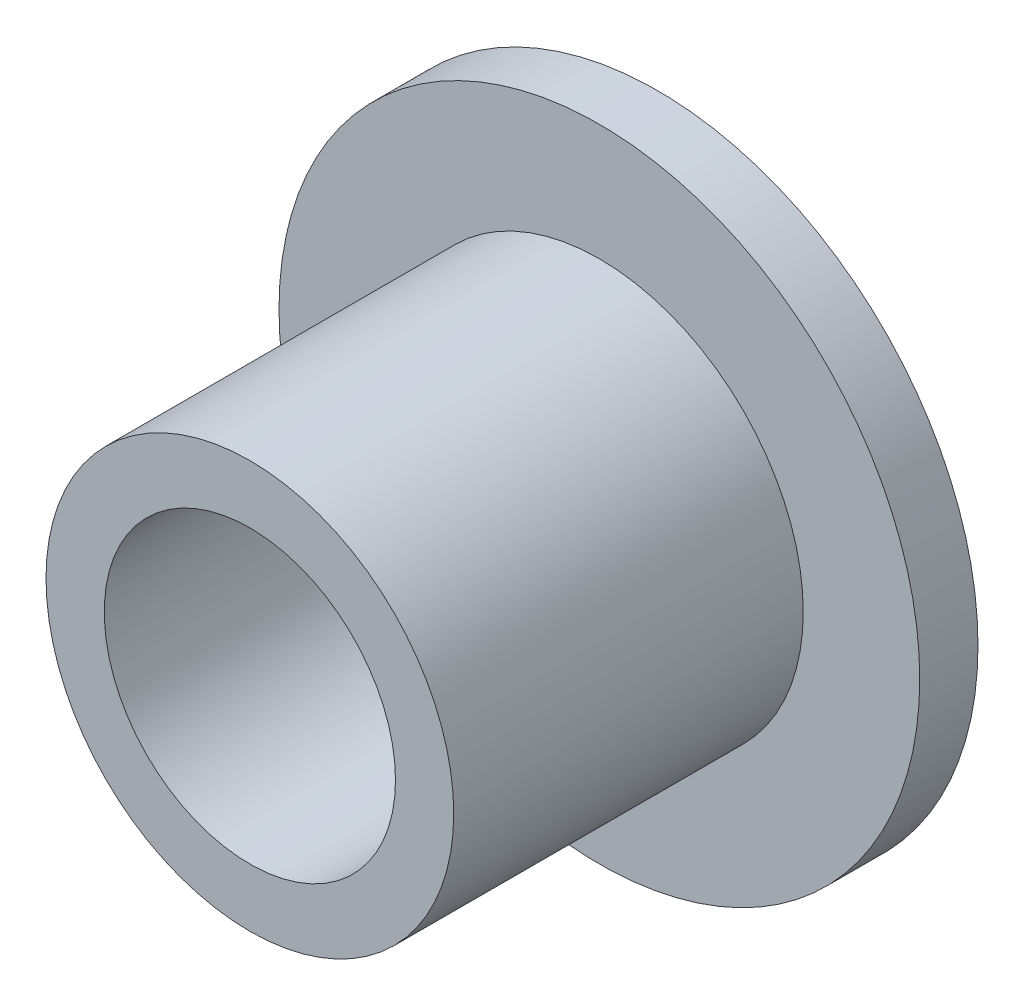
SolidWorks part; units mm, degrees
ref_plane "Ebene vorne" through (0, 0, 0) normal (0, 0, 1) x (1, 0, 0)
ref_plane "Ebene oben" through (0, 0, 0) normal (0, 1, 0) x (1, 0, 0)
ref_plane "Ebene rechts" through (0, 0, 0) normal (1, 0, 0) x (0, 0, -1)
sketch "Skizze1" plane through (0, 0, 0) normal (1, 0, 0) x (0, 0, -1)
  line L0 (0, 2.5) -> (7, 2.5)
  line L1 (7, 2.5) -> (7, 5.5)
  line L2 (7, 5.5) -> (6, 5.5)
  line L3 (6, 5.5) -> (6, 3.5)
  line L4 (6, 3.5) -> (0, 3.5)
  line L5 (0, 3.5) -> (0, 2.5)
  line L6 (0, 0) -> (8.9871, 0) construction
  dimension "D1" = 2.5
  dimension "D2" = 3.5
  dimension "D3" = 7
  dimension "D4" = 1
  dimension "D5" = 5.5
revolve "Rotation1" add sketch "Skizze1" angle 360 about L6
